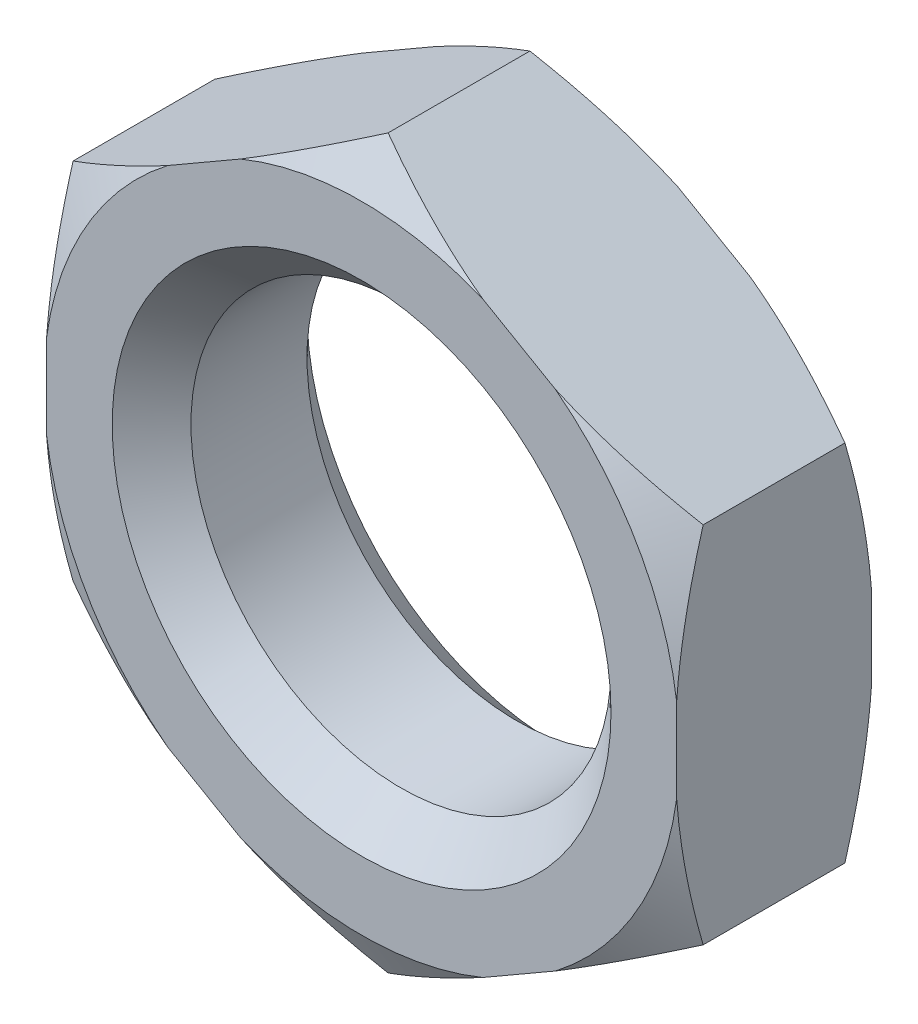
SolidWorks part; units mm, degrees
ref_plane "Front Plane" through (0, 0, 0) normal (0, 0, 1) x (1, 0, 0)
ref_plane "Top Plane" through (0, 0, 0) normal (0, 1, 0) x (1, 0, 0)
ref_plane "Right Plane" through (0, 0, 0) normal (1, 0, 0) x (0, 0, -1)
sketch "Sketch3" plane through (0, 0, 0) normal (0, 0, 1) x (1, 0, 0)
  line L1 (0, 13.8564) -> (-12, 6.9282)
  line L2 (-12, 6.9282) -> (-12, -6.9282)
  line L3 (-12, -6.9282) -> (0, -13.8564)
  line L4 (0, -13.8564) -> (12, -6.9282)
  line L5 (12, -6.9282) -> (12, 6.9282)
  line L6 (12, 6.9282) -> (0, 13.8564)
  circle A0 centre (0, 0) radius 12 construction
  dimension "D1" = 24
extrude "Boss-Extrude1" add sketch "Sketch3" along normal mid plane 7.42
sketch "Sketch4" plane through (0, 0, 0) normal (1, 0, 0) x (0, 0, -1)
  line L0 (-5.4578, 0) -> (6.1545, 0) construction
sketch "Sketch5" plane through (0, 0, 0) normal (1, 0, 0) x (0, 0, -1)
  line L0 (-3.71, 13.8564) -> (-3.71, 12.1064)
  line L1 (-3.71, 6.9282) -> (-3.71, 13.8564) construction
  line L2 (-3.71, 12.1064) -> (-2.6996, 13.8564)
  line L3 (-3.71, 13.8564) -> (3.71, 13.8564) construction
  line L4 (-2.6996, 13.8564) -> (-3.71, 13.8564)
  dimension "D1" = 1.75
  dimension "D2" = 30
revolve "Cut-Revolve1" cut sketch "Sketch5" angle 360 about L0
mirror "Mirror1" about plane through (0, 0, 0) normal (0, 0, 1) of "Cut-Revolve1"
sketch "Sketch6" plane through (0, 0, 3.71) normal (0, 0, 1) x (1, 0, 0)
  circle A0 centre (0, 0) radius 8
  dimension "D1" = 16
extrude "Cut-Extrude1" cut sketch "Sketch6" against normal blind 7.42
chamfer "Chamfer1" distance 1.5 angle 45 2 edges at (8, 0, -3.71) (8, 0, 3.71)
